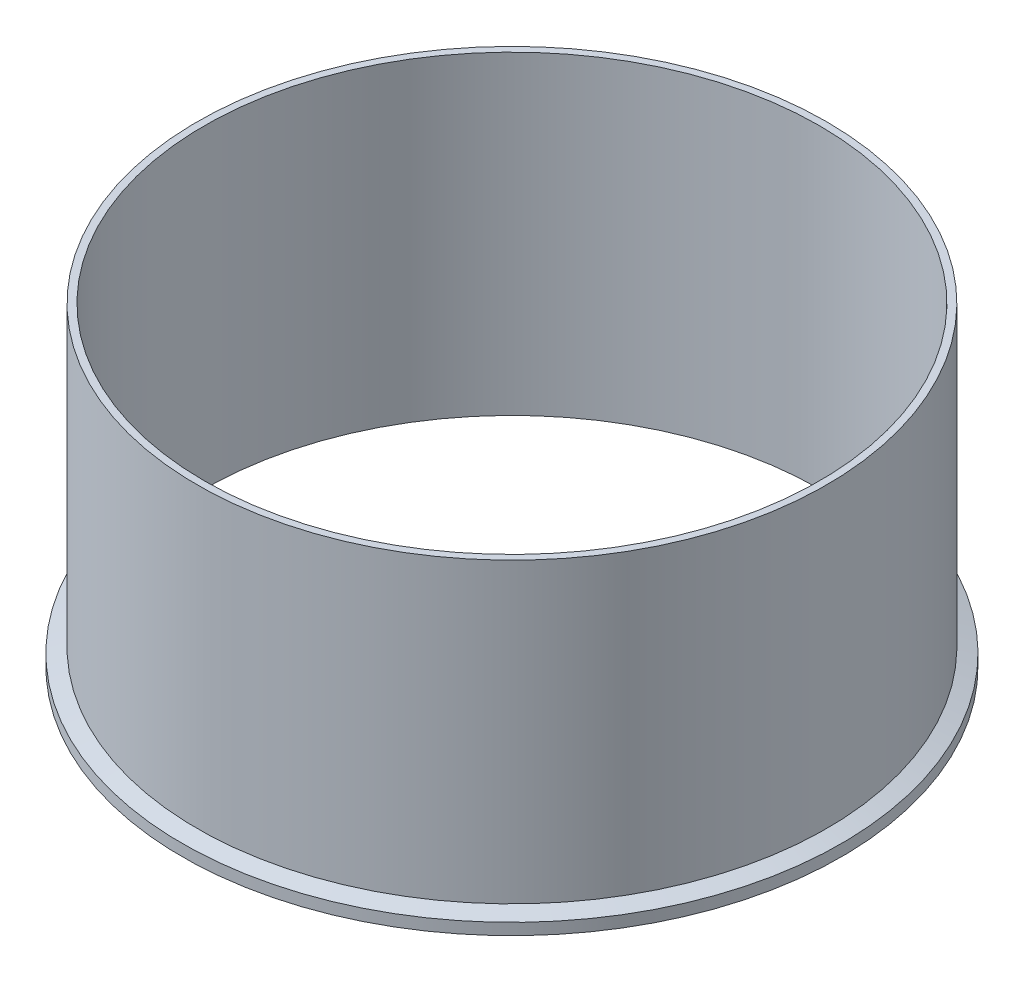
SolidWorks part; units mm, degrees
ref_plane "Front Plane" through (0, 0, 0) normal (0, 0, 1) x (1, 0, 0)
ref_plane "Top Plane" through (0, 0, 0) normal (0, 1, 0) x (1, 0, 0)
ref_plane "Right Plane" through (0, 0, 0) normal (1, 0, 0) x (0, 0, -1)
sketch "Sketch1" plane through (0, 0, 0) normal (0, 0, 1) x (1, 0, 0)
  line L0 (0, 0) -> (0, 152.4) construction
  line L1 (0, 152.4) -> (-152.4, 152.4)
  line L2 (-152.4, 152.4) -> (-152.4, 8.2228)
  line L3 (-152.4, 8.2228) -> (-159.639, 5.588)
  line L4 (-159.639, 5.588) -> (-159.639, 0)
  line L5 (-159.639, 0) -> (-156.1992, 0)
  line L6 (-152.5632, 0) -> (0, 0)
  line L7 (0, 0) -> (0, 152.4)
  line L8 (0, 152.4) -> (-148.9964, 152.4)
  line L9 (-148.9964, 152.4) -> (-148.9964, 0)
  line L10 (-148.9964, 0) -> (0, 0)
  line L11 (0, 0) -> (-0.1846, 0.0129)
  arc A0 (-155.4767, 0.4745) -> (-153.2857, 0.4745) centre (-154.3812, 0) cw
  arc A1 (-152.5632, 0) -> (-153.2857, 0.4745) centre (-152.5632, 0.7874) cw
  arc A2 (-155.4767, 0.4745) -> (-156.1992, 0) centre (-156.1992, 0.7874) cw
  point P12 (-153.1874, 0)
  dimension "D6" = 1.1938
  dimension "D7" = 0.7874
  dimension "3.00" = 152.4
  dimension "D2" = 5.588
  dimension "D3" = 159.639
  dimension "D4" = 70
  dimension "D5" = 154.3812
  dimension "D8" = 3.4036
  dimension "D9" = 152.4
revolve "Revolve2" add sketch "Sketch1" angle 360 about L0
